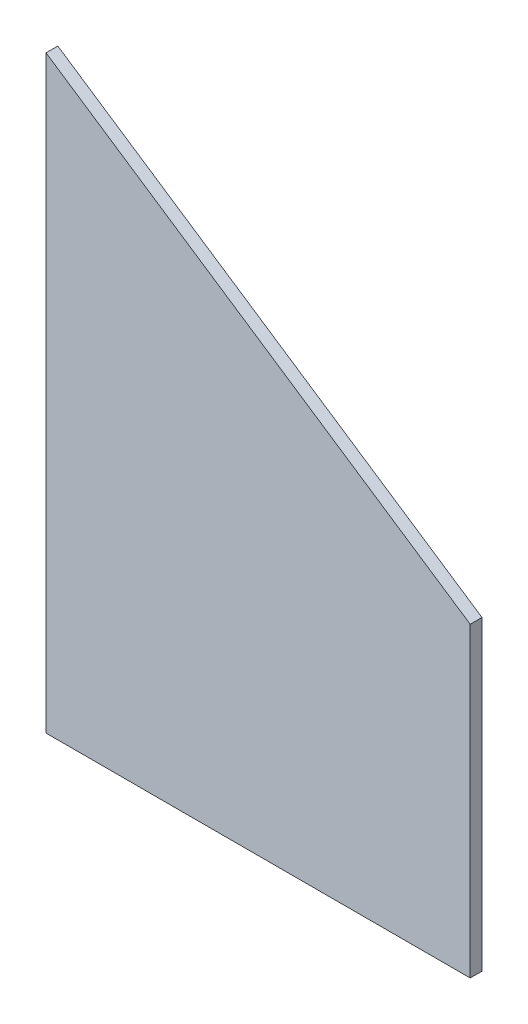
SolidWorks part; units mm, degrees
ref_plane "Front Plane" through (0, 0, 0) normal (1, 0, 0) x (0, 1, 0)
ref_plane "Top Plane" through (0, 0, 0) normal (0, 0, 1) x (0, 1, 0)
ref_plane "Right Plane" through (0, 0, 0) normal (0, 1, 0) x (-1, 0, 0)
sketch "Sketch1" plane through (0, 0, 0) normal (1, 0, 0) x (0, 1, 0)
  line L1 (-158.75, -158.75) -> (158.75, -158.75)
  line L2 (-158.75, -158.75) -> (-158.75, -152.4)
  line L3 (-158.75, -152.4) -> (158.75, -152.4)
  line L4 (158.75, -158.75) -> (158.75, -152.4)
ref_plane "Plane1" through (304.8, 0, 0) normal (1, 0, 0) x (0, 1, 0)
sketch "Sketch2" plane through (304.8, 0, 0) normal (1, 0, 0) x (0, 1, 0)
  line L1 (-82.55, -82.55) -> (82.55, -82.55)
  line L2 (-82.55, -82.55) -> (-82.55, -76.2)
  line L3 (-82.55, -76.2) -> (82.55, -76.2)
  line L4 (82.55, -82.55) -> (82.55, -76.2)
loft "Tapered_plywood_panel" add profiles "Sketch1", "Sketch2"
